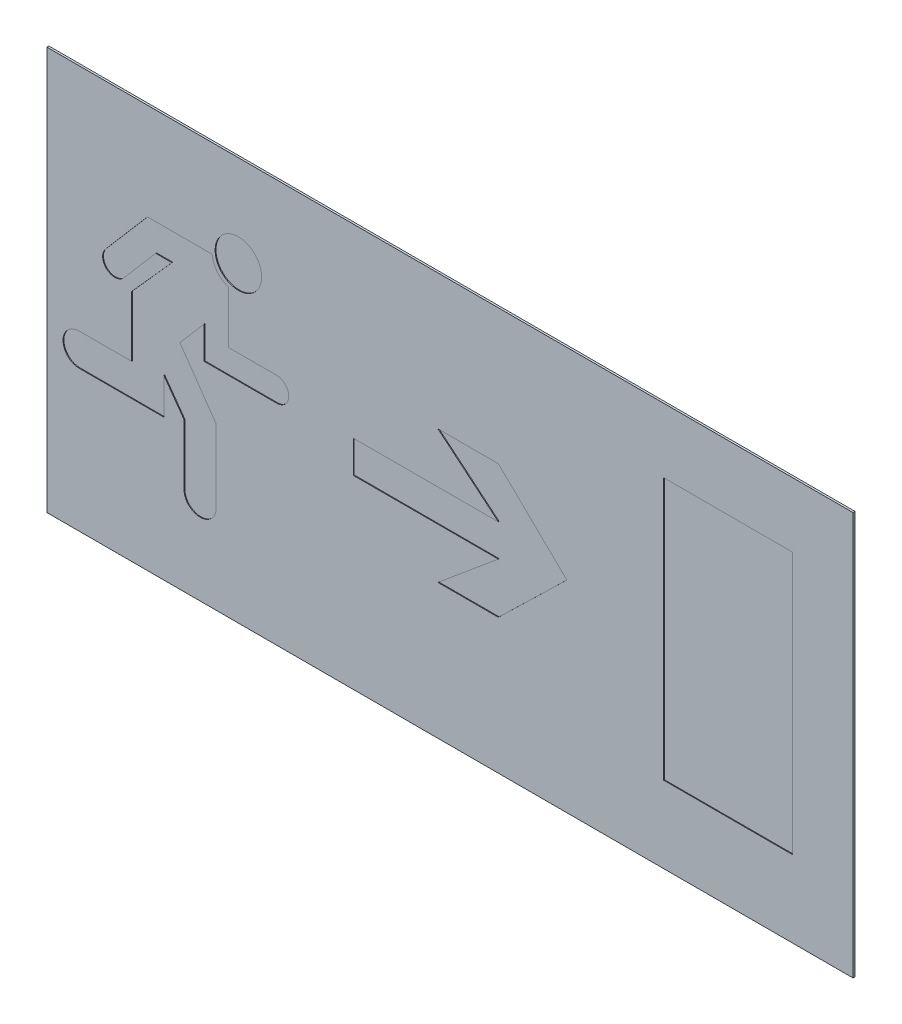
SolidWorks part; units mm, degrees
ref_plane "Plan de face" through (0, 0, 0) normal (0, 0, 1) x (1, 0, 0)
ref_plane "Plan de dessus" through (0, 0, 0) normal (0, 1, 0) x (1, 0, 0)
ref_plane "Plan de droite" through (0, 0, 0) normal (1, 0, 0) x (0, 0, -1)
sketch "Esquisse1" plane through (0, 0, 0) normal (0, 0, 1) x (1, 0, 0)
  line L1 (-100, 50) -> (100, 50)
  line L2 (-100, 50) -> (-100, -50)
  line L3 (-100, -50) -> (100, -50)
  line L4 (100, 50) -> (100, -50)
  dimension "D1" = 200
  dimension "D2" = 100
  dimension "D3" = 100
  dimension "D4" = 50
extrude "Extrusion1" add sketch "Esquisse1" along normal blind 0.5
sketch "Esquisse2" plane through (0, 0, 0.5) normal (0, 0, 1) x (1, 0, 0)
  line L0 (100, 50) -> (-100, 50) construction
  line L1 (53, 34) -> (85, 34)
  line L2 (53, 34) -> (53, -31)
  line L3 (53, -31) -> (85, -31)
  line L4 (85, 34) -> (85, -31)
  line L5 (-100, -50) -> (100, -50) construction
  line L6 (100, -50) -> (100, 50) construction
  dimension "D1" = 16
  dimension "D2" = 19
  dimension "D3" = 15
  dimension "D4" = 32
extrude "Enlèv. mat.-Extru.1" cut sketch "Esquisse2" against normal blind 0.2
sketch "Esquisse4" plane through (0, 0, 0.5) normal (0, 0, 1) x (1, 0, 0)
  line L0 (-44.1224, 0) -> (33.8164, 0) construction
  line L1 (-24, 4) -> (-24, -4)
  line L2 (-100, 50) -> (-100, -50) construction
  line L3 (-24, 4) -> (22.8663, 4) construction
  line L4 (-24, -4) -> (22.8663, -4) construction
  line L5 (29, 20.7729) -> (29, -24.6377) construction
  line L6 (-16.7472, 16.5) -> (33.8164, 16.5) construction
  line L7 (-10.628, -16.5) -> (37.6812, -16.5) construction
  line L8 (12, 27.5362) -> (12, -28.5024) construction
  line L9 (12, 16.5) -> (29, 0)
  line L10 (29, 0) -> (12, -16.5)
  line L11 (12, 16.5) -> (-3, 16.5)
  line L12 (12, -16.5) -> (-3, -16.5)
  line L13 (6, 6.5093) -> (6, -8.8687) construction
  line L14 (-3, 16.5) -> (12, 4)
  line L15 (12, 4) -> (-24, 4)
  line L16 (-24, -4) -> (12, -4)
  line L17 (12, -4) -> (-3, -16.5)
  dimension "D1" = 76
  dimension "D2" = 8
  dimension "D3" = 4
  dimension "D4" = 53
  dimension "D5" = 16.5
  dimension "D6" = 33
  dimension "D7" = 17
  dimension "D8" = 15
  dimension "D9" = 30
  dimension "D10" = 134.145
  dimension "D11" = 19.5256
  dimension "D12" = 19.5256
  dimension "D13" = 36
extrude "Enlèv. mat.-Extru.2" cut sketch "Esquisse4" against normal blind 0.2
sketch "Esquisse6" plane through (0, 0, 0.5) normal (0, 0, 1) x (1, 0, 0)
  line L0 (-79, -7) -> (-79, 8)
  line L1 (-100, -50) -> (100, -50) construction
  line L2 (100, 50) -> (-100, 50) construction
  line L4 (-100, 50) -> (-100, -50) construction
  line L5 (-79, 17.5523) -> (-79, -19.4847) construction
  line L6 (-58, -10) -> (-67, 3)
  line L7 (-92, -15) -> (-71, -15)
  line L8 (-92, -7) -> (-79, -7)
  line L9 (-55, 21) -> (-55, 8)
  line L11 (-69, 19.197) -> (-73, 19.197)
  line L13 (-79, 8) -> (-69, 19.197)
  line L14 (-66, -13) -> (-66, -28)
  line L15 (-58, -28) -> (-58, -10)
  line L17 (-71, -15) -> (-71, -6)
  line L18 (-71, -6) -> (-66, -13)
  line L21 (-73, 19.197) -> (-80.9008, 10)
  line L24 (-85.452, 13.9098) -> (-75.0657, 26)
  line L25 (-75.0657, 26) -> (-59, 26)
  line L28 (-67, 3) -> (-61, 10)
  line L29 (-61, 10) -> (-61, 2)
  line L30 (-61, 2) -> (-43, 2)
  line L34 (-55, 8) -> (-43, 8)
  arc A0 (-92, -7) -> (-92, -15) centre (-92, -11) ccw
  arc A1 (-66, -28) -> (-58, -28) centre (-62, -28) ccw
  arc A2 (-85.452, 13.9098) -> (-80.9008, 10) centre (-83.1764, 11.9549) ccw
  arc A3 (-43, 2) -> (-43, 8) centre (-43, 5) ccw
  arc A4 (-59, 26) -> (-55, 21) centre (-53.3209, 26.4433) ccw
  circle A5 centre (-52.5, 27.25) radius 5.7678
  dimension "D5" = 22
  dimension "D34" = 5.6964
  dimension "D37" = 11.5355
  dimension "D2" = 35
  dimension "D3" = 8
  dimension "D4" = 21
  dimension "D6" = 21
  dimension "D7" = 15
  dimension "D8" = 9
  dimension "D9" = 15.0124
  dimension "D10" = 15.8114
  dimension "D11" = 8
  dimension "D12" = 8.6023
  dimension "D13" = 31
  dimension "D14" = 8
  dimension "D15" = 34
  dimension "D16" = 69.197
  dimension "D17" = 19.0992
  dimension "D18" = 4
  dimension "D19" = 60
  dimension "D20" = 6
  dimension "D21" = 14.548
  dimension "D22" = 41
  dimension "D23" = 16.0657
  dimension "D24" = 8
  dimension "D25" = 18
  dimension "D26" = 33
  dimension "D27" = 58
  dimension "D28" = 57
  dimension "D29" = 53
  dimension "D30" = 60
  dimension "D31" = 39
  dimension "D32" = 71
  dimension "D33" = 13
  dimension "D35" = 47.5
  dimension "D36" = 22.75
extrude "Enlèv. mat.-Extru.3" cut sketch "Esquisse6" against normal blind 0.2
